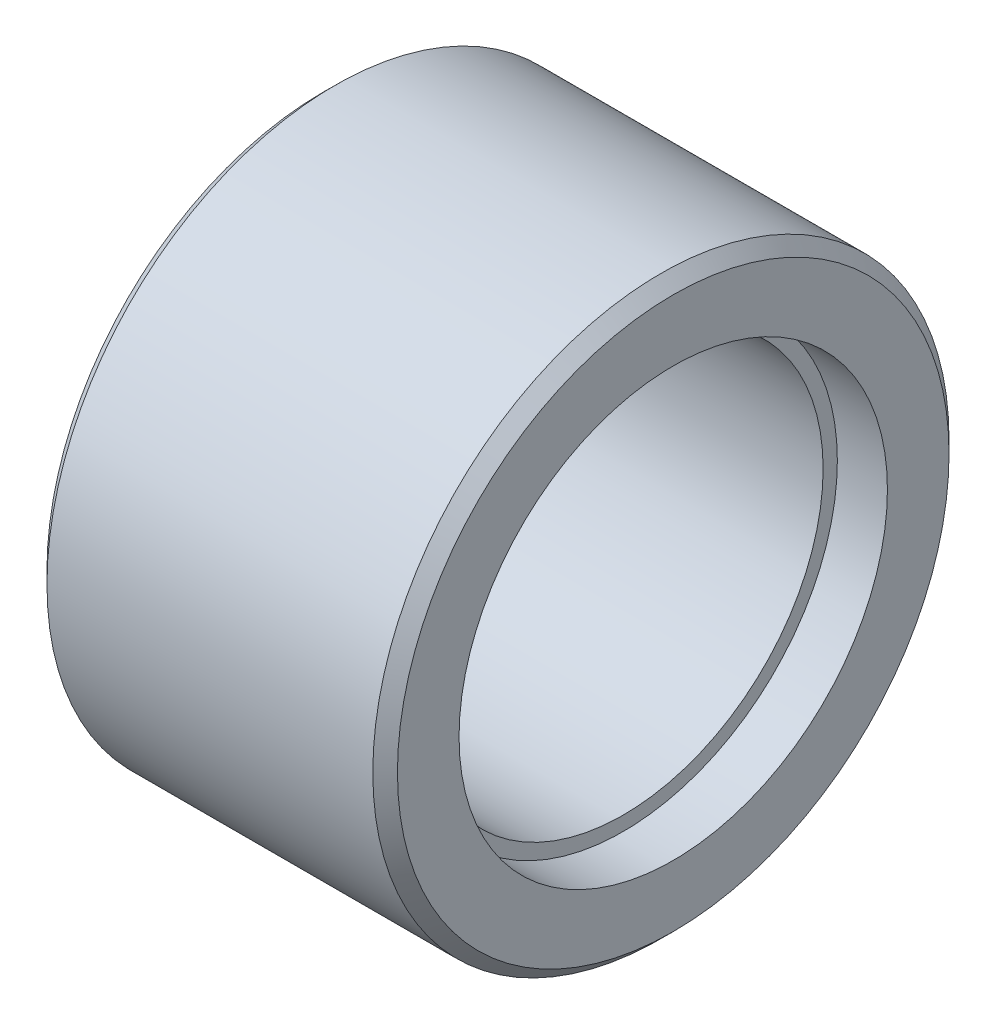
SolidWorks part; units mm, degrees
ref_plane "Front Plane" through (0, 0, 0) normal (0, 0, 1) x (1, 0, 0)
ref_plane "Top Plane" through (0, 0, 0) normal (0, 1, 0) x (1, 0, 0)
ref_plane "Right Plane" through (0, 0, 0) normal (1, 0, 0) x (0, 0, -1)
sketch "Sketch1" plane through (0, 0, 0) normal (0, 0, 1) x (1, 0, 0)
  line L0 (0, 0) -> (-92.7637, 0) construction
  line L1 (-75.8997, 8.6931) -> (-73.8677, 8.6931)
  line L2 (-73.8677, 8.6931) -> (-73.8677, 8.1153)
  line L3 (-73.8677, 8.1153) -> (-63.7077, 8.1153)
  line L4 (-63.7077, 8.1153) -> (-63.7077, 8.6931)
  line L5 (-63.7077, 8.6931) -> (-61.6757, 8.6931)
  line L6 (-61.6757, 8.6931) -> (-61.6757, 11.1931)
  line L7 (-62.1757, 11.6931) -> (-75.3997, 11.6931)
  line L8 (-75.8997, 11.1931) -> (-75.8997, 8.6931)
  line L9 (-75.3997, 11.6931) -> (-75.8997, 11.1931)
  line L10 (-61.6757, 11.1931) -> (-62.1757, 11.6931)
  point P10 (-61.6757, 11.6931)
  point P11 (-75.8997, 11.6931)
  dimension "D1" = 16.2306
  dimension "D2" = 17.3863
  dimension "D3" = 17.3863
  dimension "D4" = 10.16
  dimension "D5" = 2.032
  dimension "D6" = 14.224
  dimension "D7" = 3
  dimension "D11" = 0.5
  dimension "D12" = 0.5
revolve "Revolve1" add sketch "Sketch1" angle 360 about L0
